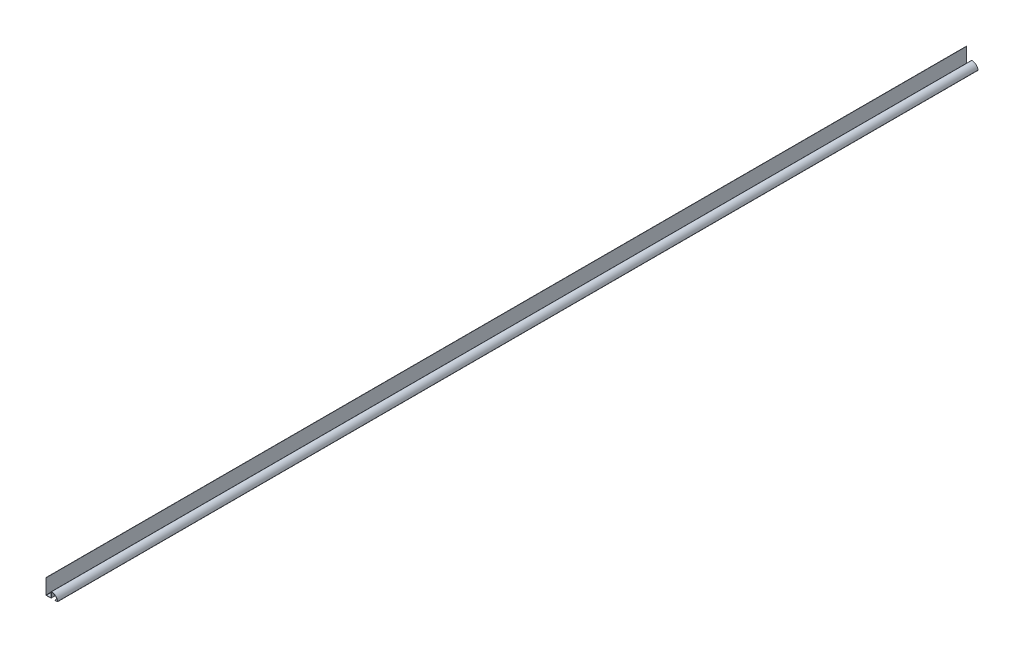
SolidWorks part; units mm, degrees
ref_plane "Front" through (0, 0, 0) normal (0, 0, 1) x (1, 0, 0)
ref_plane "Top" through (0, 0, 0) normal (0, 1, 0) x (1, 0, 0)
ref_plane "Right" through (0, 0, 0) normal (1, 0, 0) x (0, 0, -1)
sketch "Sketch1" plane through (0, 0, 0) normal (0, 0, 1) x (1, 0, 0)
  line L0 (0, 1) -> (0, 33.3375)
  line L1 (1, 0) -> (10.6205, 0)
  line L2 (11.6205, 1) -> (11.6205, 11.684)
  line L3 (24.3889, 0.508) -> (19.05, 0.508)
  line L4 (24.892, 1.0862) -> (24.892, 9.6958) construction
  arc A0 (12.1285, 12.192) -> (24.892, 1.0862) centre (12.1285, -0.6952) cw
  arc A1 (24.3889, 0.508) -> (24.892, 1.0862) centre (24.3889, 1.016) ccw
  arc A2 (10.6205, 0) -> (11.6205, 1) centre (10.6205, 1) ccw
  arc A3 (0, 1) -> (1, 0) centre (1, 1) ccw
  arc A4 (12.1285, 12.192) -> (11.6205, 11.684) centre (12.1285, 11.684) ccw
  point P10 (24.8404, 0.508)
  point P15 (11.6205, 0)
  point P18 (0, 0)
  point P19 (24.892, 5.391)
  dimension "D5" = 5.842
  dimension "D3" = 0.508
  dimension "D1" = 33.3375
  dimension "D2" = 11.6205
  dimension "D4" = 13.2715
  dimension "D6" = 0.508
  dimension "D7" = 12.192
extrude "Extrude-Thin1" add sketch "Sketch1" against normal blind 2000 thin
ref_plane "Plane1" through (0, 1, 0) normal (0, -1, 0) x (-1, 0, 0)
